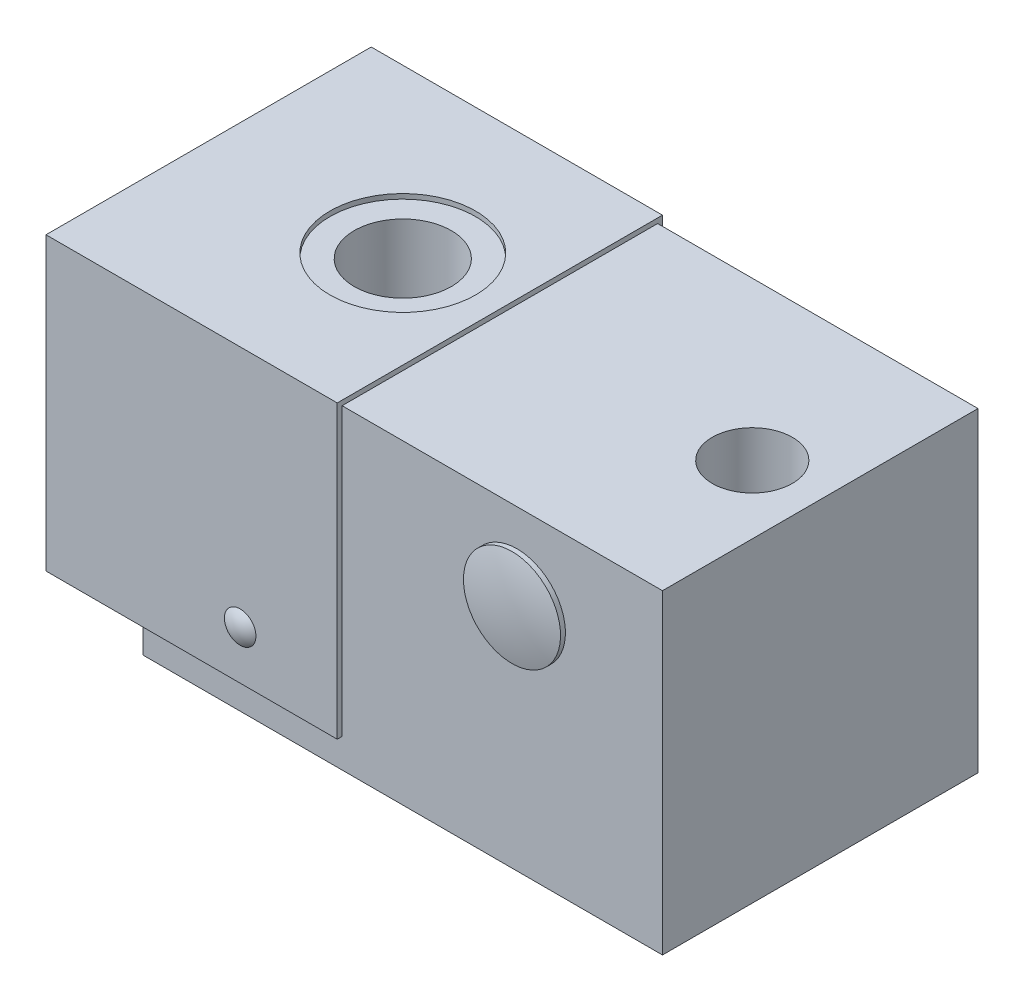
SolidWorks part; units mm, degrees
ref_plane "Front Plane" through (0, 0, 0) normal (0, 0, 1) x (1, 0, 0)
ref_plane "Top Plane" through (0, 0, 0) normal (0, 1, 0) x (1, 0, 0)
ref_plane "Right Plane" through (0, 0, 0) normal (1, 0, 0) x (0, 0, -1)
ref_plane "Plane1" through (0, 0, 0) normal (0, 1, 0) x (-1, 0, 0)
sketch "Sketch1" plane through (0, 0, 0) normal (0, 1, 0) x (-1, 0, 0)
  line L0 (60, 33.5) -> (0, 33.5)
  line L1 (0, 33.5) -> (0, 32.5)
  line L2 (0, 32.5) -> (-66, 32.5)
  line L3 (-66, 32.5) -> (-66, -32.5)
  line L4 (-66, -32.5) -> (0, -32.5)
  line L5 (0, -32.5) -> (0, -33.5)
  line L6 (0, -33.5) -> (60, -33.5)
  line L7 (60, -33.5) -> (60, 33.5)
extrude "Extrude1" add sketch "Sketch1" along normal blind 66
ref_plane "Plane2" through (0, 0, 0) normal (0, 0, 1) x (1, 0, 0)
sketch "Sketch2" plane through (0, 0, 0) normal (0, 0, 1) x (1, 0, 0)
  line L0 (0, 65) -> (66, 65)
  line L1 (66, 65) -> (66, 67)
  line L2 (66, 67) -> (0, 67)
  line L3 (0, 67) -> (0, 65)
extrude "Cut-Extrude1" cut sketch "Sketch2" against normal blind 32.5 and the other way blind 32.5
ref_plane "Plane3" through (0, 0, 0) normal (0, 0, 1) x (1, 0, 0)
sketch "Sketch3" plane through (0, 0, 0) normal (0, 0, 1) x (1, 0, 0)
  line L0 (-71, 65) -> (-71, 0)
  line L1 (-71, 0) -> (-41, 0)
  line L2 (-41, 0) -> (-41, 65)
  line L3 (-41, 65) -> (-71, 65)
extrude "Cut-Extrude2" cut sketch "Sketch3" against normal blind 32.5 and the other way blind 32.5
ref_plane "Plane4" through (0, 0, 0) normal (1, 0, 0) x (0, 0, -1)
sketch "Sketch4" plane through (0, 0, 0) normal (1, 0, 0) x (0, 0, -1)
  line L0 (-34.5, 0) -> (-32.5, 0)
  line L1 (-32.5, 0) -> (-32.5, 6)
  line L2 (-32.5, 6) -> (-34.5, 6)
  line L3 (-34.5, 6) -> (-34.5, 0)
extrude "Cut-Extrude3" cut sketch "Sketch4" against normal blind 60
ref_plane "Plane5" through (0, 0, 0) normal (1, 0, 0) x (0, 0, -1)
sketch "Sketch5" plane through (0, 0, 0) normal (1, 0, 0) x (0, 0, -1)
  line L0 (32.5, 0) -> (34.5, 0)
  line L1 (34.5, 0) -> (34.5, 6)
  line L2 (34.5, 6) -> (32.5, 6)
  line L3 (32.5, 6) -> (32.5, 0)
extrude "Cut-Extrude4" cut sketch "Sketch5" against normal blind 60
ref_plane "Plane6" through (0, 0, 0) normal (0, 0, 1) x (1, 0, 0)
sketch "Sketch6" plane through (0, 0, 0) normal (0, 0, 1) x (1, 0, 0)
  line L0 (-64.75, 32.5) -> (-64.75, 50.5)
  line L1 (-64.75, 50.5) -> (10, 50.5)
  line L2 (10, 50.5) -> (10, 48.75)
  line L3 (10, 48.75) -> (33, 48.75)
  line L4 (33, 48.75) -> (40.5775, 32.5)
  line L5 (40.5775, 32.5) -> (-64.75, 32.5)
  line L6 (40.5775, 32.5) -> (-64.75, 32.5) construction
revolve "Cut-Revolve1" cut sketch "Sketch6" angle 360 about L6
ref_plane "Plane7" through (0, 0, 0) normal (0, 0, 1) x (1, 0, 0)
sketch "Sketch7" plane through (0, 0, 0) normal (0, 0, 1) x (1, 0, 0)
  line L0 (52, 65) -> (60.25, 65)
  line L1 (60.25, 65) -> (60.25, 0)
  line L2 (60.25, 0) -> (52, 0)
  line L3 (52, 0) -> (52, 65)
  line L4 (52, 0) -> (52, 65) construction
revolve "Cut-Revolve2" cut sketch "Sketch7" angle 360 about L4
ref_plane "Plane8" through (0, 0, 23.5) normal (0, 0, 1) x (1, 0, 0)
sketch "Sketch8" plane through (0, 0, 23.5) normal (0, 0, 1) x (1, 0, 0)
  line L0 (52, 21.4179) -> (56.188, 19)
  line L1 (56.188, 19) -> (56.188, 0.812)
  line L2 (56.188, 0.812) -> (57, 0)
  line L3 (57, 0) -> (52, 0)
  line L4 (52, 0) -> (52, 21.4179)
  line L5 (52, 0) -> (52, 21.4179) construction
revolve "Cut-Revolve3" cut sketch "Sketch8" angle 360 about L5
ref_plane "Plane9" through (0, 0, 23.5) normal (0, 0, 1) x (1, 0, 0)
sketch "Sketch9" plane through (0, 0, 23.5) normal (0, 0, 1) x (1, 0, 0)
  line L0 (-31, 21.4179) -> (-26.812, 19)
  line L1 (-26.812, 19) -> (-26.812, 0.812)
  line L2 (-26.812, 0.812) -> (-26, 0)
  line L3 (-26, 0) -> (-31, 0)
  line L4 (-31, 0) -> (-31, 21.4179)
  line L5 (-31, 0) -> (-31, 21.4179) construction
revolve "Cut-Revolve4" cut sketch "Sketch9" angle 360 about L5
ref_plane "Plane10" through (0, 0, -23.5) normal (0, 0, 1) x (1, 0, 0)
sketch "Sketch10" plane through (0, 0, -23.5) normal (0, 0, 1) x (1, 0, 0)
  line L0 (52, 21.4179) -> (56.188, 19)
  line L1 (56.188, 19) -> (56.188, 0.812)
  line L2 (56.188, 0.812) -> (57, 0)
  line L3 (57, 0) -> (52, 0)
  line L4 (52, 0) -> (52, 21.4179)
  line L5 (52, 0) -> (52, 21.4179) construction
revolve "Cut-Revolve5" cut sketch "Sketch10" angle 360 about L5
ref_plane "Plane11" through (0, 0, -23.5) normal (0, 0, 1) x (1, 0, 0)
sketch "Sketch11" plane through (0, 0, -23.5) normal (0, 0, 1) x (1, 0, 0)
  line L0 (-31, 21.4179) -> (-26.812, 19)
  line L1 (-26.812, 19) -> (-26.812, 0.812)
  line L2 (-26.812, 0.812) -> (-26, 0)
  line L3 (-26, 0) -> (-31, 0)
  line L4 (-31, 0) -> (-31, 21.4179)
  line L5 (-31, 0) -> (-31, 21.4179) construction
revolve "Cut-Revolve6" cut sketch "Sketch11" angle 360 about L5
ref_plane "Plane12" through (0, 0, 0) normal (0, 0, 1) x (1, 0, 0)
sketch "Sketch12" plane through (0, 0, 0) normal (0, 0, 1) x (1, 0, 0)
  line L0 (-20, 66) -> (-5, 66)
  line L1 (-5, 66) -> (-5, 65)
  line L2 (-5, 65) -> (-10, 65)
  line L3 (-10, 65) -> (-10, 0)
  line L4 (-10, 0) -> (-20, 0)
  line L5 (-20, 0) -> (-20, 66)
  line L6 (-20, 0) -> (-20, 66) construction
revolve "Cut-Revolve7" cut sketch "Sketch12" angle 360 about L6
ref_plane "Plane13" through (36, 0, 0) normal (1, 0, 0) x (0, 0, -1)
sketch "Sketch13" plane through (36, 0, 0) normal (1, 0, 0) x (0, 0, -1)
  line L0 (32.5, 47.5) -> (32.5, 40.9215)
  line L1 (32.5, 40.9215) -> (31.644, 41.7775)
  line L2 (31.644, 41.7775) -> (-31.644, 41.7775)
  line L3 (-31.644, 41.7775) -> (-32.5, 40.9215)
  line L4 (-32.5, 40.9215) -> (-32.5, 47.5)
  line L5 (-32.5, 47.5) -> (32.5, 47.5)
  line L6 (-32.5, 47.5) -> (32.5, 47.5) construction
revolve "Cut-Revolve8" cut sketch "Sketch13" angle 360 about L6
ref_plane "Plane14" through (36, 0, 0) normal (1, 0, 0) x (0, 0, -1)
sketch "Sketch14" plane through (36, 0, 0) normal (1, 0, 0) x (0, 0, -1)
  line L0 (-22.5, 47.5) -> (-22.5, 41.7775)
  line L1 (-22.5, 41.7775) -> (-32.5, 41.7775)
  line L2 (-32.5, 41.7775) -> (-32.5, 37.5)
  line L3 (-32.5, 37.5) -> (-33.5, 37.5)
  line L4 (-34.7702, 47.5) -> (-22.5, 47.5)
  line L5 (-34.7702, 47.5) -> (-22.5, 47.5) construction
  arc A0 (-33.5, 37.5) -> (-34.7702, 47.5) centre (5.2298, 47.5) cw
revolve "Revolve1" add sketch "Sketch14" angle 360 about L5
ref_plane "Plane15" through (36, 0, 0) normal (1, 0, 0) x (0, 0, -1)
sketch "Sketch15" plane through (36, 0, 0) normal (1, 0, 0) x (0, 0, -1)
  line L0 (34.5, 47.5) -> (34.5, 38.5)
  line L1 (34.5, 38.5) -> (32.5, 38.5)
  line L2 (32.5, 38.5) -> (32.5, 40.9215)
  line L3 (32.5, 40.9215) -> (22.5, 40.9215)
  line L4 (22.5, 40.9215) -> (22.5, 47.5)
  line L5 (22.5, 47.5) -> (34.5, 47.5)
  line L6 (22.5, 47.5) -> (34.5, 47.5) construction
revolve "Revolve2" add sketch "Sketch15" angle 360 about L6
ref_plane "Plane16" through (0, 0, -34.5) normal (0, 0, -1) x (-1, 0, 0)
sketch "Sketch16" plane through (0, 0, -34.5) normal (0, 0, -1) x (-1, 0, 0)
  line L0 (-33.9793, 51) -> (-38.0207, 51)
  line L1 (-38.0207, 51) -> (-40.0415, 47.5)
  line L2 (-40.0415, 47.5) -> (-38.0207, 44)
  line L3 (-38.0207, 44) -> (-33.9793, 44)
  line L4 (-33.9793, 44) -> (-31.9585, 47.5)
  line L5 (-31.9585, 47.5) -> (-33.9793, 51)
extrude "Cut-Extrude5" cut sketch "Sketch16" against normal blind 5
ref_plane "Plane17" through (-20, 0, 0) normal (1, 0, 0) x (0, 0, -1)
sketch "Sketch17" plane through (-20, 0, 0) normal (1, 0, 0) x (0, 0, -1)
  line L0 (-29.7, 21) -> (-29.7, 11)
  line L1 (-29.7, 21) -> (-29.7, 11) construction
  arc A0 (-29.7, 11) -> (-29.7, 21) centre (-29.7, 16) cw
revolve "Revolve3" add sketch "Sketch17" angle 90 about L1
ref_plane "Plane18" through (-20, 0, 0) normal (1, 0, 0) x (0, 0, -1)
sketch "Sketch18" plane through (-20, 0, 0) normal (1, 0, 0) x (0, 0, -1)
  line L0 (29.7, 11) -> (29.7, 21)
  line L1 (29.7, 11) -> (29.7, 21) construction
  arc A0 (29.7, 21) -> (29.7, 11) centre (29.7, 16) cw
revolve "Revolve4" add sketch "Sketch18" angle 90 about L1
ref_plane "Plane19" through (0, 0, 0) normal (0, 0, 1) x (1, 0, 0)
sketch "Sketch19" plane through (0, 0, 0) normal (0, 0, 1) x (1, 0, 0)
  line L0 (34.5, 32.5) -> (36.51, 32.5)
  line L1 (36.51, 32.5) -> (36.51, 2)
  line L2 (36.51, 2) -> (41.5, 2)
  line L3 (41.5, 2) -> (41.5, 0)
  line L4 (41.5, 0) -> (34.5, 0)
  line L5 (34.5, 0) -> (34.5, 32.5)
  line L6 (34.5, 0) -> (34.5, 32.5) construction
revolve "Cut-Revolve9" cut sketch "Sketch19" angle 360 about L6
ref_plane "Plane20" through (0, 2, 0) normal (0, -1, 0) x (1, 0, 0)
sketch "Sketch20" plane through (0, 2, 0) normal (0, -1, 0) x (1, 0, 0)
  circle A0 centre (34.5, 0) radius 4.55
extrude "Cut-Extrude6" cut sketch "Sketch20" against normal blind 4.5
ref_plane "Plane21" through (0, 0, 0) normal (0, 0, 1) x (1, 0, 0)
sketch "Sketch21" plane through (0, 0, 0) normal (0, 0, 1) x (1, 0, 0)
  line L0 (34.5, 16.5) -> (36.5, 16.5)
  line L1 (36.5, 16.5) -> (37, 16)
  line L2 (37, 16) -> (37, 6.5)
  line L3 (37, 6.5) -> (38.75, 6.5)
  line L4 (38.75, 6.5) -> (38.75, 2)
  line L5 (38.25, 1.5) -> (34.5, 1.5)
  line L6 (34.5, 1.5) -> (34.5, 16.5)
  line L7 (34.5, 1.5) -> (34.5, 16.5) construction
  arc A0 (38.75, 2) -> (38.25, 1.5) centre (38.25, 2) cw
revolve "Revolve5" add sketch "Sketch21" angle 360 about L7
ref_plane "Plane22" through (0, 1.5, 0) normal (0, -1, 0) x (1, 0, 0)
sketch "Sketch22" plane through (0, 1.5, 0) normal (0, -1, 0) x (1, 0, 0)
  line L0 (32, 1.4434) -> (32, -1.4434)
  line L1 (32, -1.4434) -> (34.5, -2.8868)
  line L2 (34.5, -2.8868) -> (37, -1.4434)
  line L3 (37, -1.4434) -> (37, 1.4434)
  line L4 (37, 1.4434) -> (34.5, 2.8868)
  line L5 (34.5, 2.8868) -> (32, 1.4434)
extrude "Cut-Extrude7" cut sketch "Sketch22" against normal blind 5
